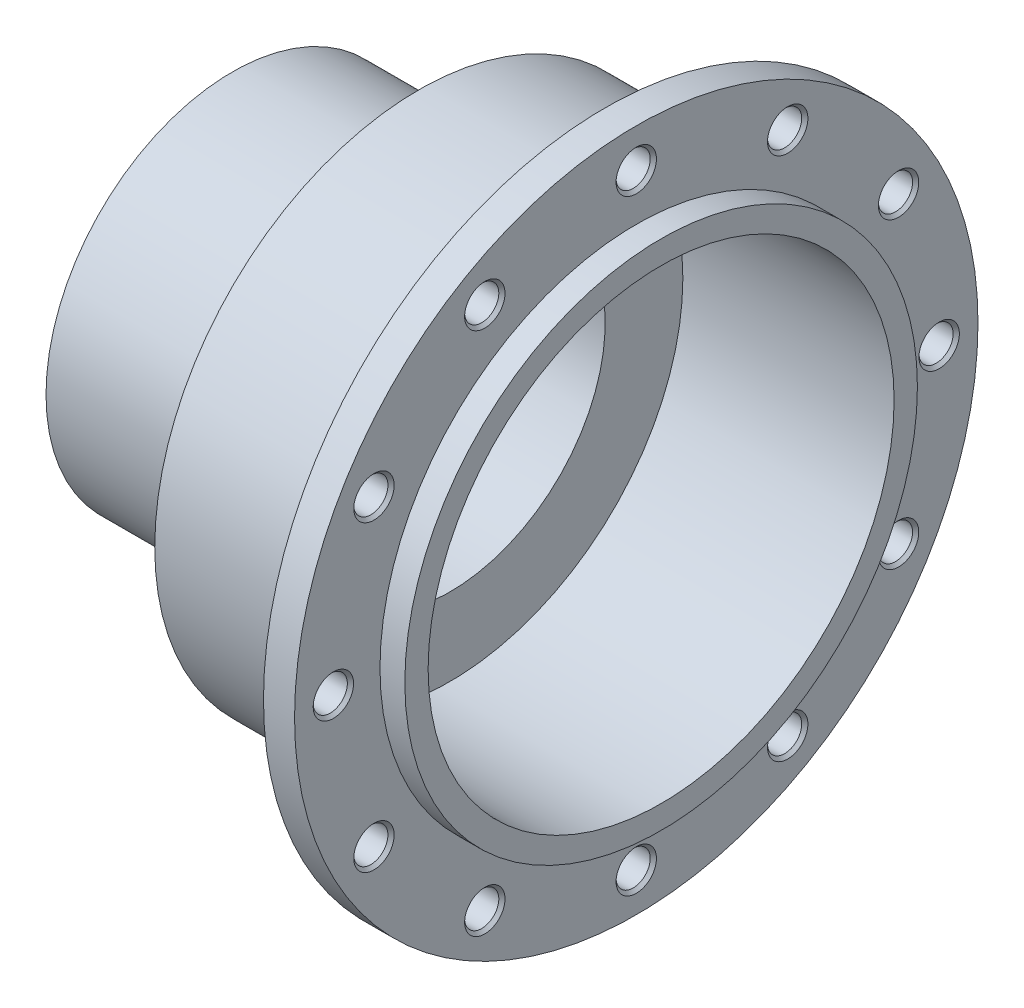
SolidWorks part; units mm, degrees
ref_plane "Płaszczyzna przednia" through (0, 0, 0) normal (0, 0, 1) x (1, 0, 0)
ref_plane "Płaszczyzna górna" through (0, 0, 0) normal (0, 1, 0) x (1, 0, 0)
ref_plane "Płaszczyzna prawa" through (0, 0, 0) normal (1, 0, 0) x (0, 0, -1)
sketch "Szkic1" plane through (0, 0, 0) normal (0, 0, 1) x (1, 0, 0)
  line L0 (0, 12.75) -> (0, 60)
  line L1 (0, 60) -> (60, 60)
  line L2 (60, 60) -> (60, 85)
  line L3 (60, 85) -> (120, 85)
  line L4 (120, 85) -> (120, 110)
  line L5 (120, 110) -> (130, 110)
  line L6 (130, 110) -> (130, 75)
  line L7 (130, 75) -> (70, 75)
  line L8 (70, 75) -> (70, 50)
  line L9 (26, 30) -> (10, 30)
  line L10 (10, 30) -> (10, 12.75)
  line L11 (10, 12.75) -> (0, 12.75)
  line L12 (0, 0) -> (124.3413, 0) construction
  line L13 (26, 30) -> (26, 50)
  line L14 (26, 50) -> (70, 50)
  dimension "D1" = 25.5
  dimension "D2" = 60
  dimension "D3" = 150
  dimension "D4" = 10
  dimension "D5" = 120
  dimension "D6" = 170
  dimension "D7" = 130
  dimension "D8" = 10
  dimension "D9" = 220
  dimension "D10" = 10
  dimension "D11" = 60
  dimension "D12" = 16
  dimension "D13" = 10
revolve "Obrót1" add sketch "Szkic1" angle 360 about L12
sketch "Szkic2" plane through (120, 0, 0) normal (-1, 0, 0) x (0, 0, 1)
  line L0 (0, 110) -> (0, 85) construction
  circle A0 centre (0, 0) radius 110 construction
  circle A1 centre (0, 0) radius 85 construction
  circle A2 centre (0, 97.5) radius 5.5
  dimension "D1" = 11
extrude "Wytnij-wyciągnięcie1" cut sketch "Szkic2" against normal through all
chamfer "Sfazowanie1" distance 1 angle 45 2 edges at (120, 97.5, 5.5) (130, 97.5, 5.5)
pattern_circular "Szyk kołowy1" count 12 over 360 about axis through (0, 0, 0) along (1, 0, 0) of "Sfazowanie1", "Wytnij-wyciągnięcie1"
sketch "Szkic3" plane through (130, 0, 0) normal (1, 0, 0) x (0, 0, -1)
  circle A0 centre (0, 0) radius 82.5
  circle A1 centre (0, 0) radius 75 construction
  circle A2 centre (0, 0) radius 75
  dimension "D1" = 165
extrude "Dodanie-wyciągnięcie1" add sketch "Szkic3" along normal blind 8
sketch "Szkic4" [suppressed] plane through (130, 0, 0) normal (1, 0, 0) x (0, 0, -1)
  circle A0 centre (0, 0) radius 82.5
  dimension "D1" = 165
extrude "Wytnij-wyciągnięcie2" [suppressed] cut sketch "Szkic4" against normal blind 10
sketch "Szkic5" plane through (10, 0, 0) normal (1, 0, 0) x (0, 0, -1)
  circle A0 centre (0, 0) radius 16.5
  circle A1 centre (0, 0) radius 21
  dimension "D1" = 33
  dimension "D2" = 42
extrude "Wytnij-wyciągnięcie3" cut sketch "Szkic5" against normal blind 2
chamfer "Sfazowanie2" distance 2 angle 45 2 edges at (10, 0, -16.5) (10, 0, -21)
